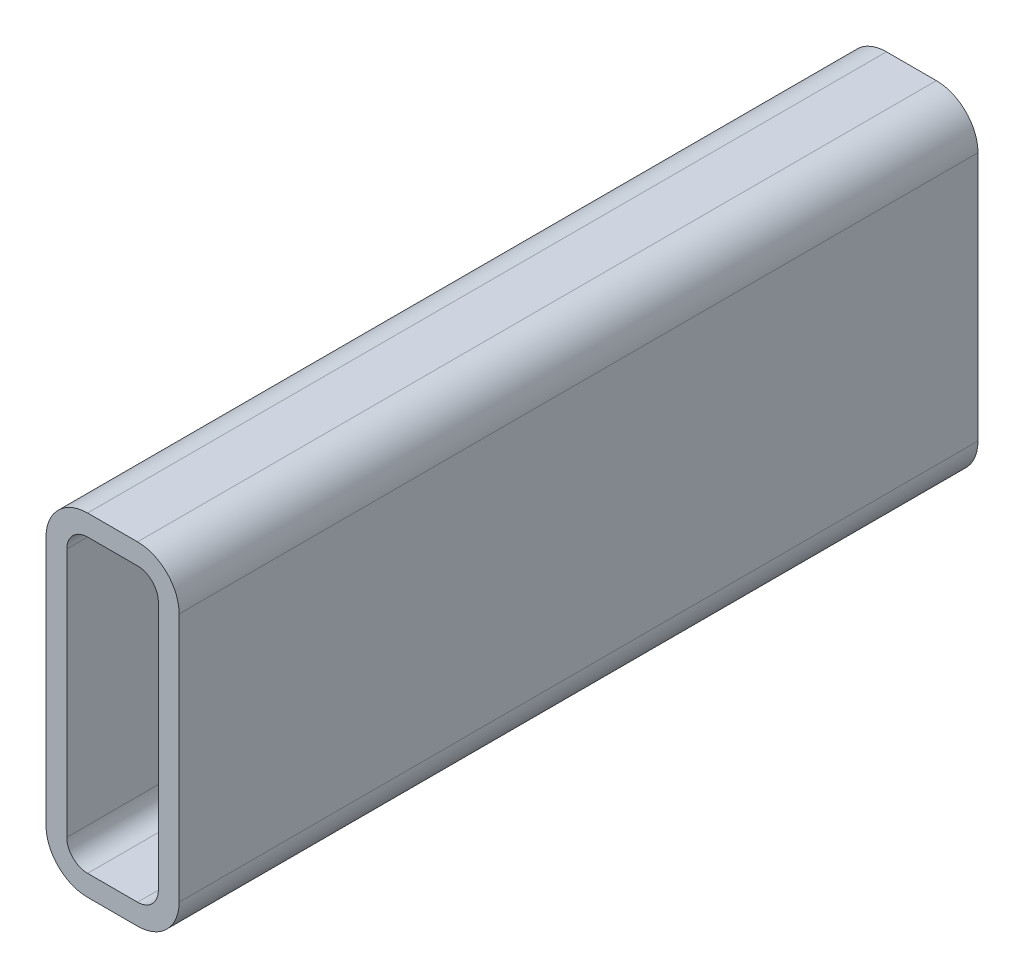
SolidWorks part; units mm, degrees
ref_plane "Front Plane" through (0, 0, 0) normal (0, 0, 1) x (1, 0, 0)
ref_plane "Top Plane" through (0, 0, 0) normal (0, 1, 0) x (1, 0, 0)
ref_plane "Right Plane" through (0, 0, 0) normal (1, 0, 0) x (0, 0, -1)
sketch "Sketch1" plane through (0, 0, 0) normal (0, 0, 1) x (1, 0, 0)
  line B0 (15.875, 127) -> (34.925, 127)
  arc B1 (50.8, 111.125) -> (34.925, 127) centre (34.925, 111.125) ccw
  line B2 (50.8, 111.125) -> (50.8, 15.875)
  arc B3 (34.925, 0) -> (50.8, 15.875) centre (34.925, 15.875) ccw
  line B4 (34.925, 0) -> (15.875, 0)
  arc B5 (0, 15.875) -> (15.875, 0) centre (15.875, 15.875) ccw
  line B6 (0, 15.875) -> (0, 111.125)
  arc B7 (15.875, 127) -> (0, 111.125) centre (15.875, 111.125) ccw
  line B8 (15.875, 119.0625) -> (34.925, 119.0625)
  arc B9 (42.8625, 111.125) -> (34.925, 119.0625) centre (34.925, 111.125) ccw
  line B10 (42.8625, 111.125) -> (42.8625, 15.875)
  arc B11 (34.925, 7.9375) -> (42.8625, 15.875) centre (34.925, 15.875) ccw
  line B12 (34.925, 7.9375) -> (15.875, 7.9375)
  arc B13 (7.9375, 15.875) -> (15.875, 7.9375) centre (15.875, 15.875) ccw
  line B14 (7.9375, 15.875) -> (7.9375, 111.125)
  arc B15 (15.875, 119.0625) -> (7.9375, 111.125) centre (15.875, 111.125) ccw
sketch_block_instance "HSS5x2x0.3125-1"
sketch_block "HSS5x2x0.3125"
extrude "Boss-Extrude1" add sketch "Sketch1" along normal blind 304.8
